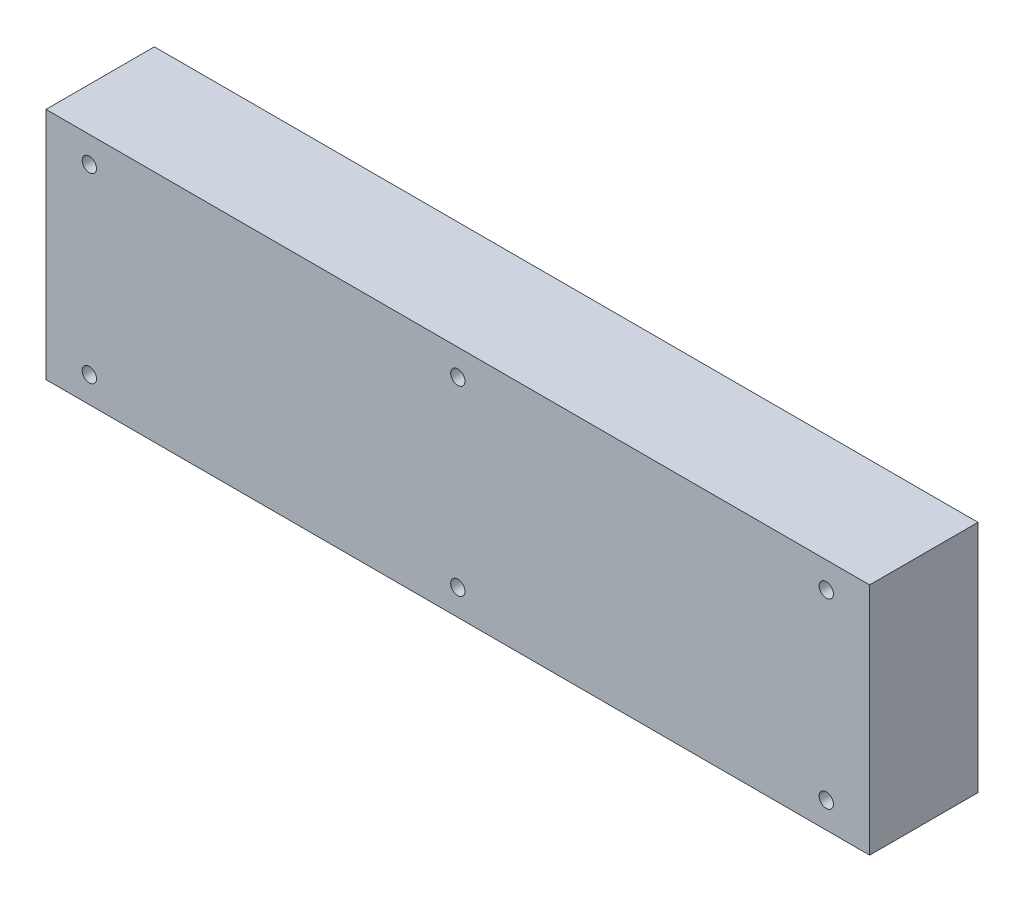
SolidWorks part; units mm, degrees
ref_plane "前视基准面" through (0, 0, 0) normal (0, 0, 1) x (1, 0, 0)
ref_plane "上视基准面" through (0, 0, 0) normal (0, 1, 0) x (1, 0, 0)
ref_plane "右视基准面" through (0, 0, 0) normal (1, 0, 0) x (0, 0, -1)
sketch "草图1" plane through (0, 0, 0) normal (0, 0, 1) x (1, 0, 0)
  line L0 (0, 0) -> (0, 54)
  line L1 (190, 0) -> (190, 54)
  line L2 (0, 54) -> (190, 54)
  line L3 (0, 0) -> (190, 0)
extrude "凸台-拉伸1" add sketch "草图1" along normal blind 25
sketch "草图2" plane through (0, 0, 25) normal (0, 0, 1) x (1, 0, 0)
  circle A0 centre (10, 48) radius 1.65
  circle A1 centre (95, 48) radius 1.65
  circle A2 centre (180, 48) radius 1.65
  circle A3 centre (180, 6) radius 1.65
  circle A4 centre (95, 6) radius 1.65
  circle A5 centre (10, 6) radius 1.65
extrude "切除-拉伸1" cut sketch "草图2" against normal blind 15
sketch "草图5" plane through (0, 0, 25) normal (0, 0, 1) x (1, 0, 0)
  circle A0 centre (20, 27) radius 2.5 construction
  circle A1 centre (95, 27) radius 2.5 construction
  circle A2 centre (170, 27) radius 2.5 construction
sketch "草图6" plane through (0, 0, 0) normal (0, 0, -1) x (-1, 0, 0)
  circle A0 centre (-170, 27) radius 2.5
  circle A1 centre (-95, 27) radius 2.5
  circle A2 centre (-20, 27) radius 2.5
extrude "切除-拉伸2" cut sketch "草图6" against normal blind 15
